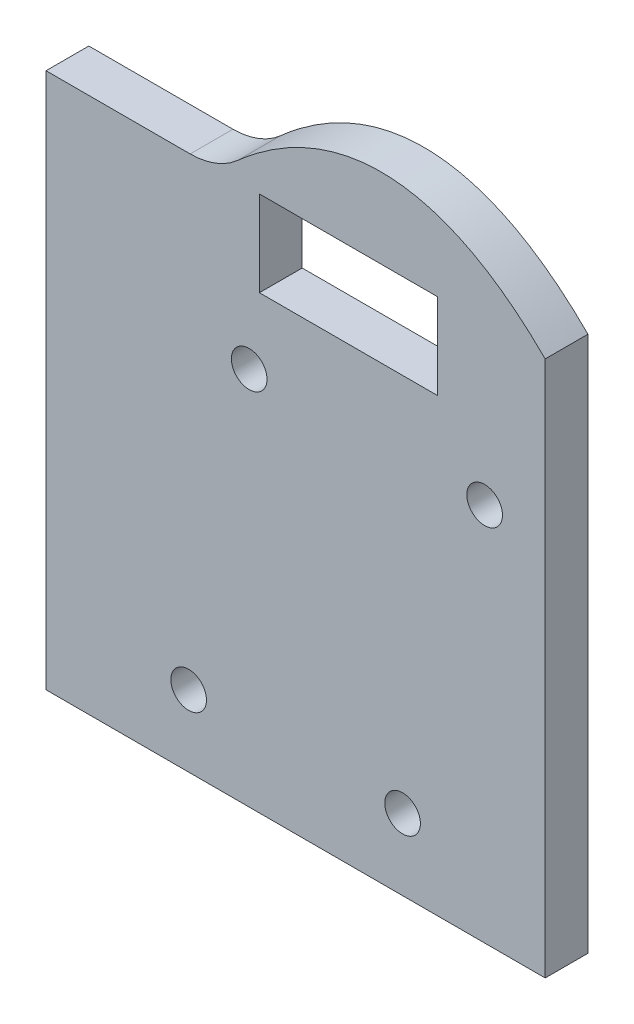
SolidWorks part; units mm, degrees
ref_plane "Front Plane" through (0, 0, 0) normal (0, 0, 1) x (1, 0, 0)
ref_plane "Top Plane" through (0, 0, 0) normal (0, 1, 0) x (1, 0, 0)
ref_plane "Right Plane" through (0, 0, 0) normal (1, 0, 0) x (0, 0, -1)
sketch "Sketch1" plane through (0, 0, 0) normal (0, 0, 1) x (1, 0, 0)
  line L0 (-201.9713, 67.8844) -> (-201.9713, -7.3014)
  line L1 (-201.9713, -7.3014) -> (-271.9713, -7.3014)
  line L2 (-271.9713, -7.3014) -> (-271.9713, 67.8844)
  line L3 (-242.0449, 67.8844) -> (-217.0449, 67.8844)
  line L4 (-271.9713, 2.6986) -> (-201.9713, 2.6986) construction
  line L5 (-236.9713, -7.3014) -> (-236.9713, 21.6863) construction
  line L6 (-201.9713, 35.8844) -> (-226.9713, 35.8844) construction
  line L7 (-210.4621, 45.8965) -> (-201.9713, 45.8965) construction
  line L8 (-217.0449, 67.8844) -> (-217.0449, 55.8844)
  line L9 (-226.9713, 35.8844) -> (-226.9713, 55.8844) construction
  line L10 (-217.0449, 55.8844) -> (-242.0449, 55.8844)
  line L11 (-242.0449, 55.8844) -> (-242.0449, 67.8844)
  line L12 (-271.9713, 67.8844) -> (-251.7596, 67.8844)
  circle A0 centre (-221.9713, 2.6986) radius 2.5
  circle A1 centre (-251.9713, 2.6986) radius 2.5
  circle A2 centre (-210.4621, 45.8965) radius 2.5
  circle A3 centre (-243.4806, 45.8965) radius 2.5
  arc A4 (-245.1233, 70.4038) -> (-251.7596, 67.8844) centre (-251.7596, 77.8844) cw
  spline S0 degree 3 poles (-245.1233, 70.4038) (-231.2161, 82.7414) (-216.0796, 81.9599) (-201.9713, 67.8844) knots 0.059912 0.059912 0.059912 0.059912 1 1 1 1
  dimension "D1" = 10
extrude "Boss-Extrude1" add sketch "Sketch1" along normal blind 6
